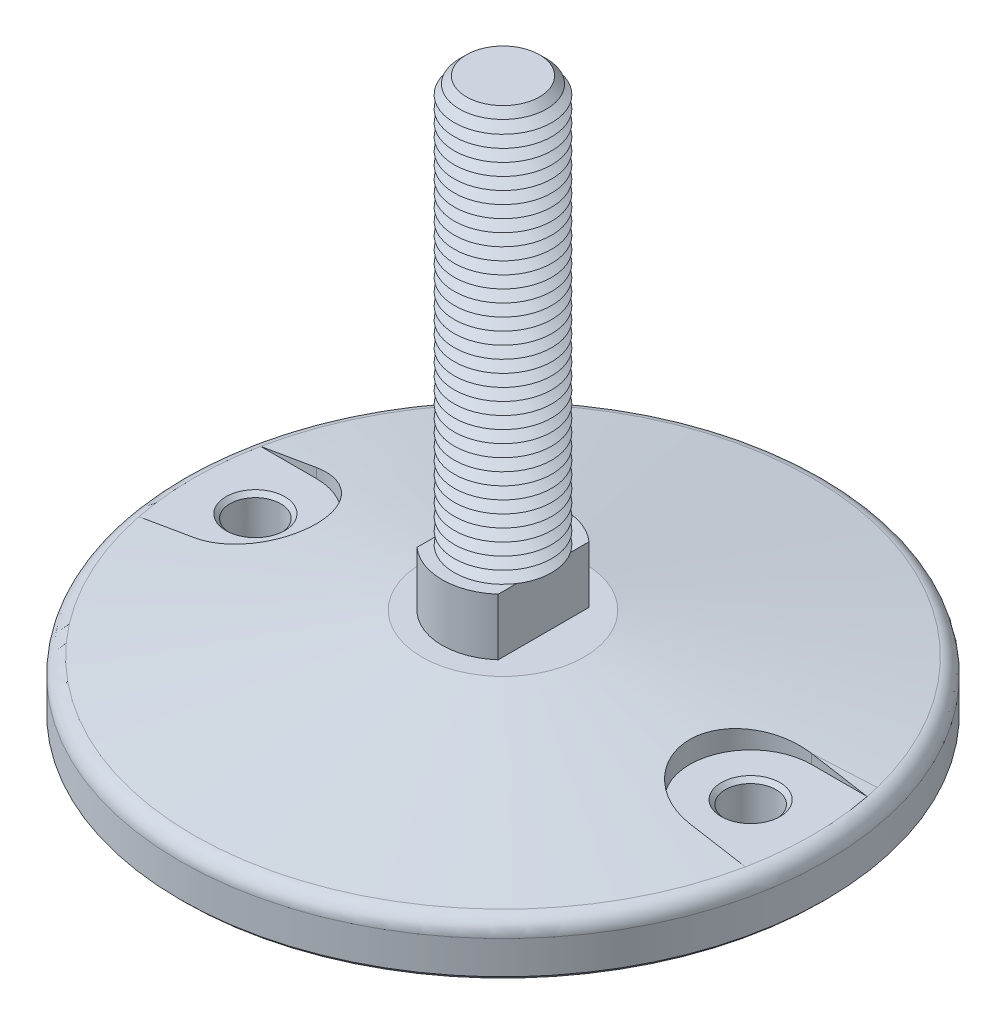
SolidWorks part; units mm, degrees
ref_plane "Front Plane" through (0, 0, 0) normal (0, 0, 1) x (1, 0, 0)
ref_plane "Top Plane" through (0, 0, 0) normal (0, 1, 0) x (1, 0, 0)
ref_plane "Right Plane" through (0, 0, 0) normal (1, 0, 0) x (0, 0, -1)
sketch "Sketch1" plane through (0, 0, 0) normal (1, 0, 0) x (0, 0, -1)
  line L0 (0, 61.3389) -> (0, -58.404) construction
sketch "Sketch2" plane through (0, 0, 0) normal (1, 0, 0) x (0, 0, -1)
  line L0 (0, 0) -> (-20, 0)
  line L1 (-20, 0) -> (-79.5, -10.4915)
  line L2 (-79.5, -10.4915) -> (-79.5, -23)
  line L3 (-79.5, -23) -> (0, -23)
  line L4 (0, 61.3389) -> (0, -58.404) construction
  line L5 (0, -23) -> (0, 0)
  dimension "D1" = 23
  dimension "D2" = 79.5
  dimension "D3" = 20
  dimension "D4" = 10
revolve "Revolve1" add sketch "Sketch2" angle 360 about L0
fillet "Fillet1" radius 4 1 edges at (0, -10.4915, 79.5)
sketch "Sketch3" plane through (0, 0, 0) normal (0, 1, 0) x (1, 0, 0)
  circle A0 centre (0, 0) radius 15
  dimension "D1" = 30
extrude "Boss-Extrude1" add sketch "Sketch3" along normal blind 14
sketch "Sketch4" plane through (0, 14, 0) normal (0, 1, 0) x (1, 0, 0)
  line L0 (-10, 11.1803) -> (-10, -11.1803)
  line L2 (10, -11.1803) -> (10, 11.1803)
  arc A0 (-10, 11.1803) -> (-10, -11.1803) centre (0, 0) ccw
  circle A1 centre (0, 0) radius 15 construction
  arc A2 (10, -11.1803) -> (10, 11.1803) centre (0, 0) ccw
  dimension "D1" = 20
extrude "Cut-Extrude1" cut sketch "Sketch4" against normal blind 14
sketch "Sketch5" plane through (0, 14, 0) normal (0, 1, 0) x (1, 0, 0)
  circle A0 centre (0, 0) radius 12
  dimension "D1" = 24
extrude "Boss-Extrude2" add sketch "Sketch5" along normal blind 100
chamfer "Chamfer1" distance 3 angle 45 1 edges at (0, 114, 12)
sketch "Sketch6" plane through (0, 0, 0) normal (1, 0, 0) x (0, 0, -1)
  line L0 (-12, 14) -> (-9.4019, 15.5)
  line L1 (-9.4019, 15.5) -> (-12, 17)
  line L2 (-12, 111) -> (-12, 14) construction
  line L3 (-12, 17) -> (-12, 14)
  dimension "D1" = 3
revolve "Cut-Revolve1" cut sketch "Sketch6" angle 360 about L0
pattern_linear "LPattern1" count 33 spacing 3 along (0, 1, 0) of "Cut-Revolve1"
sketch "Sketch8" plane through (0, 0, 0) normal (0, 1, 0) x (1, 0, 0)
  line L0 (-61, 15) -> (-74.7035, 15)
  line L1 (-61, -15) -> (-74.7035, -15)
  arc A1 (-74.7035, 15) -> (-74.7035, -15) centre (0, 0) ccw
  circle A2 centre (0, 0) radius 76.1946 construction
  arc A3 (-61, -15) -> (-61, 15) centre (-61, 0) ccw
  point P3 (-61, 0)
  point P11 (0, 0)
  dimension "D1" = 61
  dimension "D2" = 30
extrude "Cut-Extrude4" cut sketch "Sketch8" against normal blind 9.91
sketch "Sketch10" plane through (0, -9.91, 0) normal (0, 1, 0) x (1, 0, 0)
  circle A0 centre (-61, 0) radius 6.25
  dimension "D1" = 12.5
extrude "Cut-Extrude5" cut sketch "Sketch10" against normal up to surface (13.09 mm away)
chamfer "Chamfer2" distance 1 angle 45 2 edges at (-61, -23, -6.25) (-61, -9.91, 6.25)
mirror "Mirror1" about plane through (0, 0, 0) normal (1, 0, 0) of "Chamfer2", "Cut-Extrude5", "Cut-Extrude4"
chamfer "Chamfer3" distance 1 angle 45 1 edges at (0, -23, 79.5)
